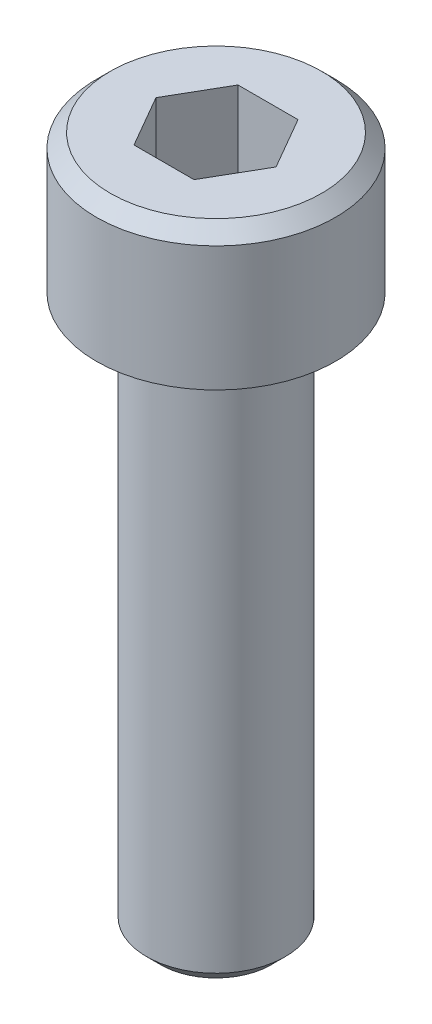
SolidWorks part; units mm, degrees
ref_plane "Face" through (0, 0, 0) normal (0, 0, 1) x (1, 0, 0)
ref_plane "Dessus" through (0, 0, 0) normal (0, 1, 0) x (1, 0, 0)
ref_plane "Droite" through (0, 0, 0) normal (1, 0, 0) x (0, 0, -1)
sketch "Esquisse1" plane through (0, 0, 0) normal (0, 0, 1) x (1, 0, 0)
  line L0 (0, 0) -> (0, 33.2066) construction
  line L1 (0, 0) -> (2, 0)
  line L2 (2, 0) -> (2, 16)
  line L3 (2, 16) -> (3.45, 16)
  line L4 (3.45, 16) -> (3.45, 20)
  line L7 (3.45, 20) -> (0, 20)
  line L8 (0, 0) -> (0, 20)
  dimension "D1" = 4
  dimension "D3" = 6.9
  dimension "D4" = 16
  dimension "D7" = 4
revolve "Révolution1" add sketch "Esquisse1" angle 360 about L0
sketch "Esquisse2" plane through (0, 20, 0) normal (0, 1, 0) x (-1, 0, 0)
  line L1 (-0.866, -1.5) -> (0.866, -1.5)
  line L2 (0.866, -1.5) -> (1.7321, 0)
  line L3 (1.7321, 0) -> (0.866, 1.5)
  line L4 (0.866, 1.5) -> (-0.866, 1.5)
  line L5 (-0.866, 1.5) -> (-1.7321, 0)
  line L6 (-1.7321, 0) -> (-0.866, -1.5)
  circle A0 centre (0, 0) radius 1.5 construction
  dimension "D1" = 3
extrude "Enlèv. mat.-Extru.1" cut sketch "Esquisse2" against normal blind 2.5
chamfer "Chanfrein1" distance 0.4 angle 45 2 edges at (0, 0, -2) (0, 20, -3.45)
